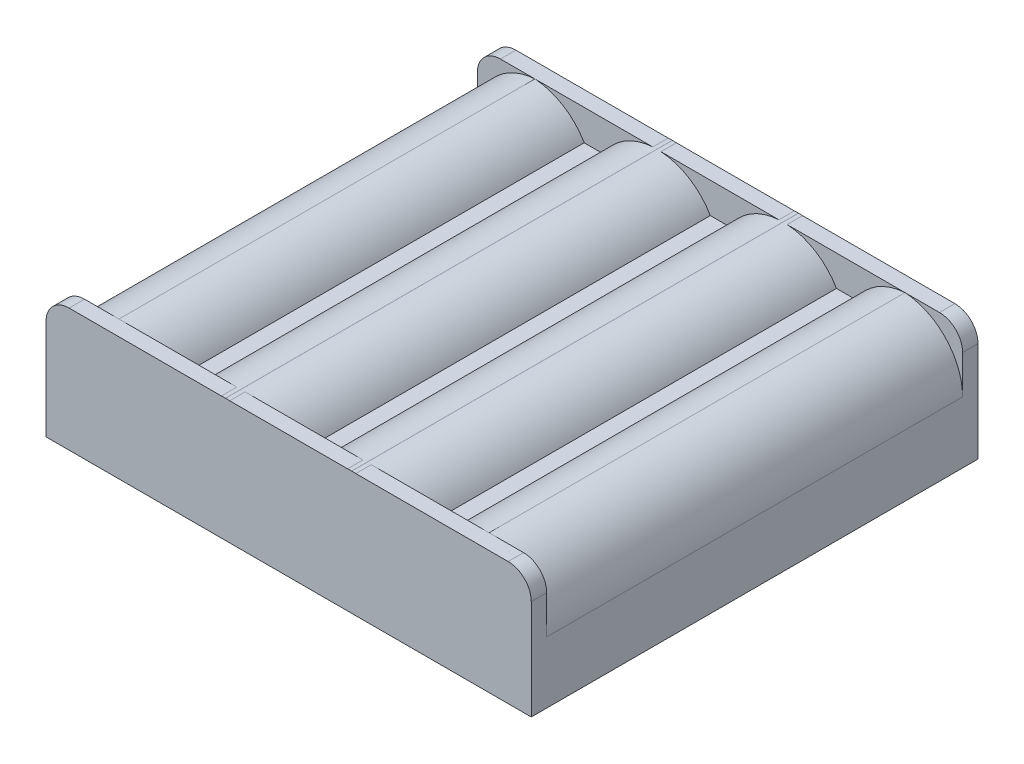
SolidWorks part; units mm, degrees
ref_plane "Front Plane" through (0, 0, 0) normal (0, 0, 1) x (1, 0, 0)
ref_plane "Top Plane" through (0, 0, 0) normal (0, 1, 0) x (1, 0, 0)
ref_plane "Right Plane" through (0, 0, 0) normal (1, 0, 0) x (0, 0, -1)
sketch "Sketch1" plane through (0, 0, 0) normal (0, 1, 0) x (1, 0, 0)
  line L1 (31.5, -29) -> (-31.5, -29)
  line L2 (31.5, -29) -> (31.5, 29)
  line L3 (31.5, 29) -> (-31.5, 29)
  line L4 (-31.5, -29) -> (-31.5, 29)
  line L5 (31.5, -29) -> (-31.5, 29) construction
  line L6 (31.5, 29) -> (-31.5, -29) construction
  point P0 (0, 0)
  dimension "D1" = 63
  dimension "D2" = 58
extrude "Boss-Extrude1" add sketch "Sketch1" along normal blind 16
fillet "Fillet1" radius 8 2 edges at (31.5, 16, 0) (-31.5, 16, 0)
sketch "Sketch2" plane through (0, 16, 0) normal (0, 1, 0) x (1, 0, 0)
  line L0 (23.5, 29) -> (-23.5, 29) construction
  line L1 (-15.125, -29) -> (-17.625, -29)
  line L2 (-15.125, -29) -> (-15.125, 29)
  line L3 (-15.125, 29) -> (-17.625, 29)
  line L4 (-17.625, -29) -> (-17.625, 29)
  line L5 (-15.125, -29) -> (-17.625, 29) construction
  line L6 (-15.125, 29) -> (-17.625, -29) construction
  line L8 (1.25, -29) -> (-1.25, -29)
  line L9 (1.25, -29) -> (1.25, 29)
  line L10 (1.25, 29) -> (-1.25, 29)
  line L11 (-1.25, -29) -> (-1.25, 29)
  line L12 (1.25, -29) -> (-1.25, 29) construction
  line L13 (1.25, 29) -> (-1.25, -29) construction
  line L14 (17.625, -29) -> (15.125, -29)
  line L15 (17.625, -29) -> (17.625, 29)
  line L16 (17.625, 29) -> (15.125, 29)
  line L17 (15.125, -29) -> (15.125, 29)
  line L18 (17.625, -29) -> (15.125, 29) construction
  line L19 (17.625, 29) -> (15.125, -29) construction
  point P0 (-16.375, 0)
  point P7 (0, 0)
  point P15 (16.375, 0)
  dimension "D1" = 58
  dimension "D2" = 58
  dimension "D3" = 2.5
  dimension "D4" = 2.5
  dimension "D5" = 58
  dimension "D6" = 2.5
  dimension "D7" = 13.875
  dimension "D8" = 13.875
extrude "Cut-Extrude1" cut sketch "Sketch2" against normal blind 4
fillet "Fillet2" radius 8 6 edges at (17.625, 16, 0) (15.125, 16, 0) (1.25, 16, 0) (-1.25, 16, 0) (-15.125, 16, 0) (-17.625, 16, 0)
sketch "Sketch4" plane through (0, 0, 29) normal (0, 0, 1) x (1, 0, 0)
  line L0 (-31.5, 0) -> (-31.5, 15.9826)
  line L1 (-31.5, 15.9826) -> (-24.0266, 15.9826)
  line L2 (-24.0266, 15.9826) -> (-7.6516, 15.9826)
  line L3 (-7.6516, 15.9826) -> (8.7048, 15.9826)
  line L4 (8.7048, 15.9826) -> (24.0266, 15.9826)
  line L5 (24.0266, 15.9826) -> (31.5, 15.9826)
  line L6 (31.5, 15.9826) -> (31.5, 0)
  line L7 (31.5, 0) -> (-31.5, 0)
  arc A0 (-1.25, 12) -> (-8.1782, 16) centre (-8.1782, 8) ccw construction
  arc A1 (8.1782, 16) -> (1.25, 12) centre (8.1782, 8) ccw construction
extrude "Boss-Extrude2" add sketch "Sketch4" against normal blind 2
mirror "Mirror1" about plane through (0, 0, 0) normal (0, 0, 1) of "Boss-Extrude2"
fillet "Fillet3" radius 3 4 edges at (-31.5, 15.9826, 28) (31.5, 15.9826, 28) (-31.5, 15.9826, -28) (31.5, 15.9826, -28)
